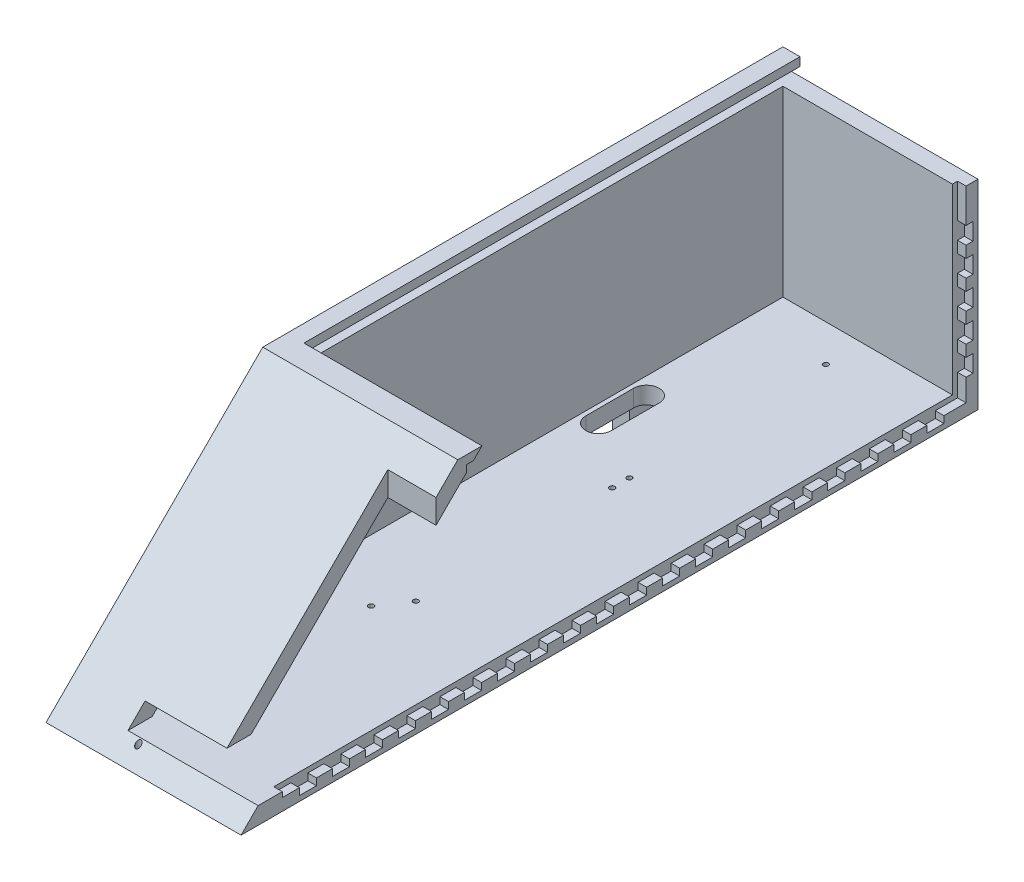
SolidWorks part; units mm, degrees
ref_plane "Front Plane" through (0, 0, 0) normal (0, 0, 1) x (1, 0, 0)
ref_plane "Top Plane" through (0, 0, 0) normal (0, 1, 0) x (1, 0, 0)
ref_plane "Right Plane" through (0, 0, 0) normal (1, 0, 0) x (0, 0, -1)
ref_plane "Metal_Det_Plane" through (0, 0, -5) normal (0, 0, -1) x (-1, 0, 0)
ref_plane "Center_Plane" through (0, 0, -215.9) normal (0, 0, -1) x (-1, 0, 0)
sketch "Centerline" plane through (0, 0, 0) normal (1, 0, 0) x (0, 0, -1)
  line L0 (-1000, 0) -> (49000, 0) construction
sketch "Sketch3" plane through (0, 0, 0) normal (1, 0, 0) x (0, 0, -1)
  line L3 (0, 0) -> (431.8, 0)
  line L4 (431.8, 0) -> (431.8, 127)
  line L5 (431.8, 127) -> (127, 127)
  line L6 (0, 0) -> (127, 127)
  point P3 (127, 0)
  point P4 (0, 0)
  dimension "D1" = 127
  dimension "D2" = 431.8
  dimension "D3" = 45
  dimension "D4" = 304.8
  dimension "D5" = 304.8
extrude "Boss-Extrude2" add sketch "Sketch3" along normal mid plane 228.6 contours L6 L5 L4 L3
shell "Shell2" thickness 10
sketch "Sketch4" plane through (0, 0, -431.8) normal (0, 0, -1) x (-1, 0, 0)
  line L0 (-104.3, 127) -> (-104.3, 122)
  line L1 (-114.3, 127) -> (114.3, 127) construction
  line L2 (-114.3, 127) -> (-114.3, 0) construction
  line L3 (-114.3, 0) -> (114.3, 0) construction
  line L4 (114.3, 127) -> (114.3, 0) construction
  line L5 (-114.3, 127) -> (114.3, 127) construction
  line L6 (-114.3, 127) -> (-114.3, 0) construction
  line L11 (-114.3, 0) -> (114.3, 0) construction
  line L13 (114.3, 127) -> (114.3, 0) construction
  line L14 (-114.3, 127) -> (114.3, 0) construction
  line L15 (-114.3, 0) -> (114.3, 127) construction
  line L16 (-104.3, 122) -> (-109.3, 122)
  line L17 (-109.3, 122) -> (-109.3, 117)
  line L18 (-109.3, 117) -> (-104.3, 117)
  line L19 (-104.3, 117) -> (-104.3, 10)
  line L20 (0, 0) -> (0, 127) construction
  line L21 (104.3, 10) -> (-104.3, 10)
  line L22 (104.3, 127) -> (104.3, 122)
  line L23 (104.3, 122) -> (109.3, 122)
  line L24 (109.3, 122) -> (109.3, 117)
  line L25 (109.3, 117) -> (104.3, 117)
  line L26 (104.3, 117) -> (104.3, 10)
  line L27 (-104.3, 117) -> (104.3, 117)
  line L28 (-104.3, 122) -> (104.3, 122)
  line L29 (-104.3, 127) -> (104.3, 127)
  point P8 (0, 63.5)
  point P20 (0, 63.5)
  point P24 (0, 10)
  dimension "D1" = 5
  dimension "D2" = 10
  dimension "D3" = 10
  dimension "D4" = 5
  dimension "D5" = 5
  dimension "D6" = 10
  dimension "D7" = 218.6
extrude "Cut-Extrude2" cut sketch "Sketch4" against normal blind 299.8 contours L27 L18 L17 L16 L28 L23 L24 L25
sketch "Sketch5" plane through (0, 0, -431.8) normal (0, 0, -1) x (-1, 0, 0)
  line L0 (-104.3, 122) -> (-104.3, 127)
  line L1 (-104.3, 127) -> (104.3, 127)
  line L2 (104.3, 127) -> (104.3, 122)
  line L3 (104.3, 122) -> (-104.3, 122)
extrude "Cut-Extrude3" cut sketch "Sketch5" against normal blind 10
ref_plane "Hardware_Surface Plane" through (0, 10, 0) normal (0, 1, 0) x (1, 0, 0)
sketch "Reference1 Base " plane through (0, 0, 0) normal (0, -1, 0) x (1, 0, 0)
  line L0 (76.2, 0) -> (-76.2, 0) construction
  line L1 (114.3, 0) -> (-114.3, 0) construction
  line L2 (-76.2, 0) -> (-76.2, -152.4) construction
  line L3 (-76.2, -152.4) -> (76.2, -152.4) construction
  line L4 (76.2, -152.4) -> (76.2, 0) construction
  line L5 (0, -69.85) -> (0, 69.85) construction
  circle A0 centre (-68.2, -144.4) radius 1.55
  circle A1 centre (-68.2, -8) radius 1.55
  circle A2 centre (68.2, -144.4) radius 1.55
  circle A3 centre (68.2, -8) radius 1.55
  point P6 (0, 0)
  dimension "D3" = 8
  dimension "D5" = 3.1
  dimension "D8" = 3.1
  dimension "D1" = 152.4
  dimension "D2" = 152.4
  dimension "D4" = 8
  dimension "D6" = 8
  dimension "D7" = 8
sketch "Reference2 Base" plane through (-114.3, 0, 0) normal (-1, 0, 0) x (0, 0, 1)
  line L0 (-10, 10) -> (-10, 0) construction
  line L1 (0, 0) -> (-127, 127) construction
  line L2 (-152.4, 0) -> (0, 0) construction
  dimension "D1" = 10
sketch "Reference3 Base" plane through (0, 0, 0) normal (0, 0.7071, 0.7071) x (1, 0, 0)
  line L0 (-114.3, 14.1421) -> (114.3, 14.1421) construction
  line L1 (114.3, 0) -> (114.3, 179.6051) construction
sketch "Base hole" plane through (0, 10, 0) normal (0, 1, 0) x (1, 0, 0)
  line L0 (-76.25, 10) -> (76.25, 10)
  line L1 (-76.25, 10) -> (-76.25, 162)
  line L2 (-76.25, 162) -> (76.25, 162)
  line L3 (76.25, 162) -> (76.25, 10)
  line L10 (-114.3, 10) -> (114.3, 10) construction
  line L12 (76.25, 162) -> (-76.25, 162) construction
  line L13 (76.25, 162) -> (76.25, 10) construction
  line L14 (76.25, 10) -> (-76.25, 10) construction
  line L15 (-76.25, 162) -> (-76.25, 10) construction
  line L16 (76.25, 162) -> (-76.25, 10) construction
  line L17 (76.25, 10) -> (-76.25, 162) construction
  point P3 (0, 10)
  point P6 (0, 86)
  dimension "D1" = 152.5
  dimension "D2" = 152
  dimension "D3" = 152
  dimension "D4" = 152.5
extrude "Cut-Extrude5" cut sketch "Base hole" along normal blind 10
sketch "Sketch16" plane through (0, 10, 0) normal (0, 1, 0) x (1, 0, 0)
  line L1 (-28.25, 114.25) -> (28.25, 114.25)
  line L2 (-28.25, 114.25) -> (-28.25, 57.75)
  line L3 (-28.25, 57.75) -> (28.25, 57.75)
  line L4 (28.25, 114.25) -> (28.25, 57.75)
  line L5 (-28.25, 114.25) -> (28.25, 57.75) construction
  line L6 (-28.25, 57.75) -> (28.25, 114.25) construction
  point P0 (0, 86)
  dimension "D1" = 56.5
  dimension "D2" = 56.5
extrude "Cut-Extrude7" cut sketch "Sketch16" along normal blind 120
sketch "Sketch17" plane through (0, 10, 0) normal (0, 1, 0) x (1, 0, 0)
  line L0 (-28.25, 57.75) -> (28.25, 57.75) construction
  line L1 (-28.25, 57.75) -> (28.25, 57.75)
  line L2 (-28.25, 57.75) -> (-28.25, 10)
  line L3 (-28.25, 10) -> (28.25, 10)
  line L4 (28.25, 57.75) -> (28.25, 10)
  line L6 (-28.25, 114.25) -> (-28.25, 57.75) construction
  line L7 (-114.3, 10) -> (114.3, 10) construction
  dimension "D1" = 56.5
extrude "Cut-Extrude8" cut sketch "Sketch17" along normal blind 120
ref_plane "Wall2 Plane" through (114.3, 0, 0) normal (1, 0, 0) x (0, 0, -1)
sketch "Sidewall_Motor_Tabs1" plane through (114.3, 0, 0) normal (1, 0, 0) x (0, 0, -1)
  line L0 (0, 0) -> (30, -30)
  line L1 (0, 0) -> (100, 0)
  line L3 (30, -30) -> (100, -30)
  line L4 (100, 0) -> (100, -30)
  line L5 (0, 0) -> (100, -30) construction
  line L6 (30, -30) -> (100, 0) construction
  line L8 (431.8, 0) -> (331.8, 0)
  line L9 (431.8, 0) -> (431.8, -30)
  line L10 (431.8, -30) -> (331.8, -30)
  line L11 (331.8, 0) -> (331.8, -30)
  line L12 (431.8, 0) -> (331.8, -30) construction
  line L13 (431.8, -30) -> (331.8, 0) construction
  point P4 (58.8235, -17.6471)
  point P13 (381.8, -15)
  dimension "D1" = 70
  dimension "D2" = 30
  dimension "D3" = 45
  dimension "D4" = 30
  dimension "D5" = 100
extrude "Motor_Mount_Wall1" add sketch "Sidewall_Motor_Tabs1" against normal blind 10
ref_plane "Wall1 Plane" through (-114.3, 0, 0) normal (-1, 0, 0) x (0, 0, 1)
sketch "Sidewall_Motor_Tabs2" plane through (-114.3, 0, 0) normal (-1, 0, 0) x (0, 0, 1)
  line L0 (0, 0) -> (-30, -30)
  line L1 (0, 0) -> (-100, 0)
  line L3 (-30, -30) -> (-100, -30)
  line L4 (-100, 0) -> (-100, -30)
  line L5 (0, 0) -> (-100, -30) construction
  line L6 (-30, -30) -> (-100, 0) construction
  line L8 (-431.8, 0) -> (-331.8, 0)
  line L9 (-431.8, 0) -> (-431.8, -30)
  line L10 (-431.8, -30) -> (-331.8, -30)
  line L11 (-331.8, 0) -> (-331.8, -30)
  line L12 (-431.8, 0) -> (-331.8, -30) construction
  line L13 (-431.8, -30) -> (-331.8, 0) construction
  point P4 (-58.8235, -17.6471)
  point P11 (-381.8, -15)
  dimension "D1" = 70
  dimension "D2" = 30
  dimension "D3" = 45
  dimension "D4" = 30
  dimension "D5" = 100
extrude "Motor_Mount_Wall2" add sketch "Sidewall_Motor_Tabs2" against normal blind 10
sketch "Side Wall Thickness Ref" plane through (-114.3, 0, 0) normal (-1, 0, 0) x (0, 0, 1)
  line L1 (-331.8, 0) -> (-100, 0) construction
  line L2 (-331.8, 0) -> (-331.8, 10) construction
  line L3 (-331.8, 10) -> (-100, 10) construction
  line L4 (-100, 0) -> (-100, 10) construction
  dimension "D1" = 10
sketch "Side Wall Thickness Ref1" plane through (0, 10, 0) normal (0, 1, 0) x (1, 0, 0)
  line L1 (-114.3, 331.8) -> (-104.3, 331.8) construction
  line L2 (-114.3, 331.8) -> (-114.3, 100) construction
  line L3 (-114.3, 100) -> (-104.3, 100) construction
  line L4 (-104.3, 331.8) -> (-104.3, 100) construction
  dimension "D1" = 10
sketch "Rear Slots" plane through (0, 10, 0) normal (0, 1, 0) x (1, 0, 0)
  line L0 (-94.3, 331.8) -> (-94.3, 303.8) construction
  line L1 (-86.8, 331.8) -> (-86.8, 303.8)
  line L2 (-101.8, 331.8) -> (-101.8, 303.8)
  line L3 (0, -69.85) -> (0, 69.85) construction
  line L4 (94.3, 331.8) -> (94.3, 303.8) construction
  line L5 (86.8, 331.8) -> (86.8, 303.8)
  line L6 (101.8, 331.8) -> (101.8, 303.8)
  arc A0 (-86.8, 331.8) -> (-101.8, 331.8) centre (-94.3, 331.8) ccw
  arc A1 (-101.8, 303.8) -> (-86.8, 303.8) centre (-94.3, 303.8) ccw
  arc A2 (86.8, 331.8) -> (101.8, 331.8) centre (94.3, 331.8) cw
  arc A3 (101.8, 303.8) -> (86.8, 303.8) centre (94.3, 303.8) cw
  point P2 (-94.3, 317.8)
  point P14 (94.3, 317.8)
  dimension "D2" = 28
  dimension "D1" = 15
  dimension "D3" = 10
extrude "Cut-Extrude_Rear Slots" cut sketch "Rear Slots" against normal blind 10
sketch "Front Slots" plane through (0, 10, 0) normal (0, 1, 0) x (1, 0, 0)
  line L0 (-94.3, 128) -> (-94.3, 100) construction
  line L1 (-86.8, 128) -> (-86.8, 100)
  line L2 (-101.8, 128) -> (-101.8, 100)
  line L3 (0, -69.85) -> (0, 69.85) construction
  line L4 (94.3, 128) -> (94.3, 100) construction
  line L5 (86.8, 128) -> (86.8, 100)
  line L6 (101.8, 128) -> (101.8, 100)
  arc A0 (-86.8, 128) -> (-101.8, 128) centre (-94.3, 128) ccw
  arc A1 (-101.8, 100) -> (-86.8, 100) centre (-94.3, 100) ccw
  arc A2 (86.8, 128) -> (101.8, 128) centre (94.3, 128) cw
  arc A3 (101.8, 100) -> (86.8, 100) centre (94.3, 100) cw
  point P2 (-94.3, 114)
  point P12 (94.3, 114)
  dimension "D1" = 15
  dimension "D2" = 28
  dimension "D3" = 10
extrude "Cut-Extrude_Front Slots" cut sketch "Front Slots" against normal blind 10
sketch "Sketch25" plane through (-114.3, 0, 0) normal (-1, 0, 0) x (0, 0, 1)
  line L0 (-331.8, -26.15) -> (-331.8, -3.85) construction
  line L1 (-331.8, 0) -> (-331.8, -30) construction
  line L2 (-331.8, -3.85) -> (-396.2, -3.85) construction
  line L3 (-396.2, -3.85) -> (-396.2, -26.15) construction
  line L4 (-396.2, -26.15) -> (-332.748, -26.15) construction
  line L5 (-331.8, -15) -> (-385.2, -15) construction
  line L6 (-365.1, -6.25) -> (-365.1, -23.75) construction
  line L7 (-215.9, 86.35) -> (-215.9, -86.35) construction
  line L8 (-66.7, -6.25) -> (-66.7, -23.75) construction
  line L9 (-100, -15) -> (-46.6, -15) construction
  line L10 (-35.6, -26.15) -> (-99.052, -26.15) construction
  line L11 (-35.6, -3.85) -> (-35.6, -26.15) construction
  line L12 (-100, -3.85) -> (-35.6, -3.85) construction
  line L13 (-100, -26.15) -> (-100, -3.85) construction
  circle A0 centre (-385.2, -15) radius 3
  circle A1 centre (-365.1, -6.25) radius 1.55
  circle A2 centre (-365.1, -23.75) radius 1.55
  circle A3 centre (-66.7, -23.75) radius 1.55
  circle A4 centre (-66.7, -6.25) radius 1.55
  circle A5 centre (-46.6, -15) radius 3
  point P5 (-331.8, -15)
  point P15 (-365.1, -15)
  point P31 (-66.7, -15)
  point P32 (-100, -15)
  dimension "D4" = 6
  dimension "D7" = 3.1
  dimension "D8" = 3.1
  dimension "D1" = 22.3
  dimension "D2" = 64.4
  dimension "D3" = 53.4
  dimension "D5" = 20.1
  dimension "D6" = 17.5
extrude "Motor_Holes" cut sketch "Sketch25" against normal through all
extrude "Cut-Extrude9" cut sketch "Reference1 Base " against normal blind 10
sketch "Sketch26" plane through (0, 0, 0) normal (0, -1, 0) x (1, 0, 0)
  line L0 (-76.2, -152.4) -> (76.2, -152.4) construction
  line L1 (-60.08, -157.4) -> (60.08, -157.4) construction
  line L2 (-60.08, -157.4) -> (-60.08, -277.56) construction
  line L3 (-60.08, -277.56) -> (60.08, -277.56) construction
  line L4 (60.08, -157.4) -> (60.08, -277.56) construction
  line L5 (-60.08, -157.4) -> (60.08, -277.56) construction
  line L6 (-60.08, -277.56) -> (60.08, -157.4) construction
  line L7 (-60.08, -282.56) -> (60.08, -282.56) construction
  line L8 (-60.08, -282.56) -> (-60.08, -402.72) construction
  line L11 (-60.08, -402.72) -> (60.08, -402.72) construction
  line L13 (0, -86.35) -> (0, 86.35) construction
  line L14 (60.08, -282.56) -> (60.08, -402.72) construction
  line L15 (-60.08, -282.56) -> (60.08, -402.72) construction
  line L16 (-60.08, -402.72) -> (60.08, -282.56) construction
  circle A0 centre (-57.54, -159.94) radius 1.5
  circle A1 centre (57.54, -159.94) radius 1.5
  circle A2 centre (-57.54, -275.02) radius 1.5
  circle A3 centre (57.54, -275.02) radius 1.5
  circle A4 centre (-57.54, -285.1) radius 1.5
  circle A6 centre (-57.54, -400.18) radius 1.5
  circle A8 centre (57.54, -285.1) radius 1.5
  circle A9 centre (57.54, -400.18) radius 1.5
  point P4 (0, -217.48)
  point P23 (0, -342.64)
  dimension "D7" = 3
  dimension "D10" = 2.54
  dimension "D12" = 3
  dimension "D13" = 3
  dimension "D4" = 120.16
  dimension "D17" = 3
  dimension "D1" = 120.16
  dimension "D2" = 120.16
  dimension "D3" = 5
  dimension "D5" = 120.16
  dimension "D6" = 2.54
  dimension "D8" = 2.54
  dimension "D9" = 2.54
  dimension "D11" = 2.54
  dimension "D14" = 2.54
  dimension "D15" = 2.54
  dimension "D16" = 2.54
  dimension "D18" = 5
extrude "Cut-Extrude_TowerBase_Holes" cut sketch "Sketch26" against normal blind 10
sketch "Sketch27" plane through (0, 0, 0) normal (1, 0, 0) x (0, 0, -1)
  line L0 (431.8, -30) -> (331.8, -30) construction
  line L1 (431.8, 127) -> (0, 127)
  line L2 (431.8, 127) -> (431.8, -30)
  line L3 (431.8, -30) -> (0, -30)
  line L4 (0, 127) -> (0, -30)
extrude "Cut-Extrude10" cut sketch "Sketch27" along normal through all
sketch "Sketch28" plane through (0, 0, 0) normal (1, 0, 0) x (0, 0, -1)
  line L0 (421.8, 10) -> (10, 10) construction
  line L1 (24.1421, 10) -> (421.8, 10)
  line L2 (24.1421, 10) -> (24.1421, 7)
  line L3 (24.1421, 7) -> (424.8, 7)
  line L6 (421.8, 117) -> (424.8, 117)
  line L7 (421.8, 117) -> (421.8, 10)
  line L9 (424.8, 117) -> (424.8, 7)
  dimension "D1" = 3
  dimension "D2" = 3
extrude "Cut-Extrude11" cut sketch "Sketch28" against normal blind 5 contours L6 L9 L3 L2 L1 L7
sketch "Sketch31" plane through (0, 0, 0) normal (1, 0, 0) x (0, 0, -1)
  line L6 (424.8, 20) -> (428.8, 20)
  line L84 (401.8, 7) -> (411.8, 7)
  line L85 (401.8, 7) -> (401.8, 3)
  line L86 (401.8, 3) -> (411.8, 3)
  line L87 (411.8, 7) -> (411.8, 3)
  line L89 (431.8, 0) -> (0, 0) construction
  line L90 (382.4496, 7) -> (382.4496, 3)
  line L91 (382.4496, 7) -> (392.4496, 7)
  line L92 (392.4496, 7) -> (392.4496, 3)
  line L93 (382.4496, 3) -> (392.4496, 3)
  line L94 (363.0992, 7) -> (363.0992, 3)
  line L95 (363.0992, 7) -> (373.0992, 7)
  line L96 (373.0992, 7) -> (373.0992, 3)
  line L97 (363.0992, 3) -> (373.0992, 3)
  line L98 (343.7488, 7) -> (343.7488, 3)
  line L99 (343.7488, 7) -> (353.7488, 7)
  line L100 (353.7488, 7) -> (353.7488, 3)
  line L101 (343.7488, 3) -> (353.7488, 3)
  line L102 (324.3983, 7) -> (324.3983, 3)
  line L103 (324.3983, 7) -> (334.3983, 7)
  line L104 (334.3983, 7) -> (334.3983, 3)
  line L105 (324.3983, 3) -> (334.3983, 3)
  line L106 (305.0479, 7) -> (305.0479, 3)
  line L107 (305.0479, 7) -> (315.0479, 7)
  line L108 (315.0479, 7) -> (315.0479, 3)
  line L109 (305.0479, 3) -> (315.0479, 3)
  line L110 (285.6975, 7) -> (285.6975, 3)
  line L111 (285.6975, 7) -> (295.6975, 7)
  line L112 (295.6975, 7) -> (295.6975, 3)
  line L113 (285.6975, 3) -> (295.6975, 3)
  line L114 (266.3471, 7) -> (266.3471, 3)
  line L115 (266.3471, 7) -> (276.3471, 7)
  line L116 (276.3471, 7) -> (276.3471, 3)
  line L117 (266.3471, 3) -> (276.3471, 3)
  line L118 (246.9967, 7) -> (246.9967, 3)
  line L119 (246.9967, 7) -> (256.9967, 7)
  line L120 (256.9967, 7) -> (256.9967, 3)
  line L121 (246.9967, 3) -> (256.9967, 3)
  line L122 (227.6463, 7) -> (227.6463, 3)
  line L123 (227.6463, 7) -> (237.6463, 7)
  line L124 (237.6463, 7) -> (237.6463, 3)
  line L125 (227.6463, 3) -> (237.6463, 3)
  line L126 (208.2959, 7) -> (208.2959, 3)
  line L127 (208.2959, 7) -> (218.2959, 7)
  line L128 (218.2959, 7) -> (218.2959, 3)
  line L129 (208.2959, 3) -> (218.2959, 3)
  line L130 (188.9454, 7) -> (188.9454, 3)
  line L131 (188.9454, 7) -> (198.9454, 7)
  line L132 (198.9454, 7) -> (198.9454, 3)
  line L133 (188.9454, 3) -> (198.9454, 3)
  line L134 (169.595, 7) -> (169.595, 3)
  line L135 (169.595, 7) -> (179.595, 7)
  line L136 (179.595, 7) -> (179.595, 3)
  line L137 (169.595, 3) -> (179.595, 3)
  line L138 (150.2446, 7) -> (150.2446, 3)
  line L139 (150.2446, 7) -> (160.2446, 7)
  line L140 (160.2446, 7) -> (160.2446, 3)
  line L141 (150.2446, 3) -> (160.2446, 3)
  line L142 (130.8942, 7) -> (130.8942, 3)
  line L143 (130.8942, 7) -> (140.8942, 7)
  line L144 (140.8942, 7) -> (140.8942, 3)
  line L145 (130.8942, 3) -> (140.8942, 3)
  line L146 (111.5438, 7) -> (111.5438, 3)
  line L147 (111.5438, 7) -> (121.5438, 7)
  line L148 (121.5438, 7) -> (121.5438, 3)
  line L149 (111.5438, 3) -> (121.5438, 3)
  line L150 (92.1934, 7) -> (92.1934, 3)
  line L151 (92.1934, 7) -> (102.1934, 7)
  line L152 (102.1934, 7) -> (102.1934, 3)
  line L153 (92.1934, 3) -> (102.1934, 3)
  line L154 (72.843, 7) -> (72.843, 3)
  line L155 (72.843, 7) -> (82.843, 7)
  line L156 (82.843, 7) -> (82.843, 3)
  line L157 (72.843, 3) -> (82.843, 3)
  line L158 (53.4925, 7) -> (53.4925, 3)
  line L159 (53.4925, 7) -> (63.4925, 7)
  line L160 (63.4925, 7) -> (63.4925, 3)
  line L161 (53.4925, 3) -> (63.4925, 3)
  line L162 (34.1421, 7) -> (34.1421, 3)
  line L163 (34.1421, 7) -> (44.1421, 7)
  line L164 (44.1421, 7) -> (44.1421, 3)
  line L165 (34.1421, 3) -> (44.1421, 3)
  line L166 (424.8, 20) -> (424.8, 30)
  line L167 (424.8, 30) -> (428.8, 30)
  line L168 (428.8, 20) -> (428.8, 30)
  line L169 (431.8, 0) -> (431.8, 117) construction
  line L170 (424.8, 36.75) -> (424.8, 46.75)
  line L171 (424.8, 36.75) -> (428.8, 36.75)
  line L172 (428.8, 36.75) -> (428.8, 46.75)
  line L173 (424.8, 46.75) -> (428.8, 46.75)
  line L174 (424.8, 53.5) -> (424.8, 63.5)
  line L175 (424.8, 53.5) -> (428.8, 53.5)
  line L176 (428.8, 53.5) -> (428.8, 63.5)
  line L177 (424.8, 63.5) -> (428.8, 63.5)
  line L178 (424.8, 70.25) -> (424.8, 80.25)
  line L179 (424.8, 70.25) -> (428.8, 70.25)
  line L180 (428.8, 70.25) -> (428.8, 80.25)
  line L181 (424.8, 80.25) -> (428.8, 80.25)
  line L182 (424.8, 87) -> (424.8, 97)
  line L183 (424.8, 87) -> (428.8, 87)
  line L184 (428.8, 87) -> (428.8, 97)
  line L185 (424.8, 97) -> (428.8, 97)
  line L186 (424.8, 117) -> (431.8, 117) construction
  line L189 (24.1421, 7) -> (424.8, 7) construction
  line L190 (421.8, 117) -> (421.8, 10) construction
  line L191 (24.1421, 10) -> (421.8, 10) construction
  line L192 (424.8, 117) -> (424.8, 7) construction
  dimension "D2" = 10
  dimension "D4" = 20
  dimension "D5" = 10
  dimension "D3" = 3
  dimension "D6" = 10
  dimension "D7" = 10
  dimension "D8" = 3
  dimension "D10" = 20
  dimension "D11" = 10
  dimension "D9" = 5
extrude "Cut-Extrude12" cut sketch "Sketch31" against normal blind 5 contours L85 L84 L87 L86 | L178 L181 L180 L179 | L174 L177 L176 L175 | L170 L173 L172 L171 | L166 L6 L168 L167 | L90 L93 L92 L91 | L98 L101 L100 L99 | L102 L105 L104 L103 | L94 L97 L96 L95 | L106 L109 L108 L107 | L110 L113 L112 L111 | L114 L117 L116 L115 | L118 L121 L120 L119 | L122 L125 L124 L123 | L126 L129 L128 L127 | L130 L133 L132 L131 | L134 L137 L136 L135 | L138 L141 L140 L139 | L142 L145 L144 L143 | L146 L149 L148 L147 | L150 L153 L152 L151 | L154 L157 L156 L155 | L158 L161 L160 L159 | L162 L165 L164 L163 | L182 L185 L184 L183
sketch "Sketch32" plane through (-114.3, 0, 0) normal (-1, 0, 0) x (0, 0, 1)
  line L0 (0, 0) -> (-431.8, 0) construction
  line L1 (-215.9, 0) -> (-215.9, 127) construction
  line L2 (-431.8, 127) -> (-127, 127) construction
  point P4 (-215.9, 0)
ref_plane "Plane1" through (0, 0, -215.9) normal (0, 0, 1) x (1, 0, 0)
